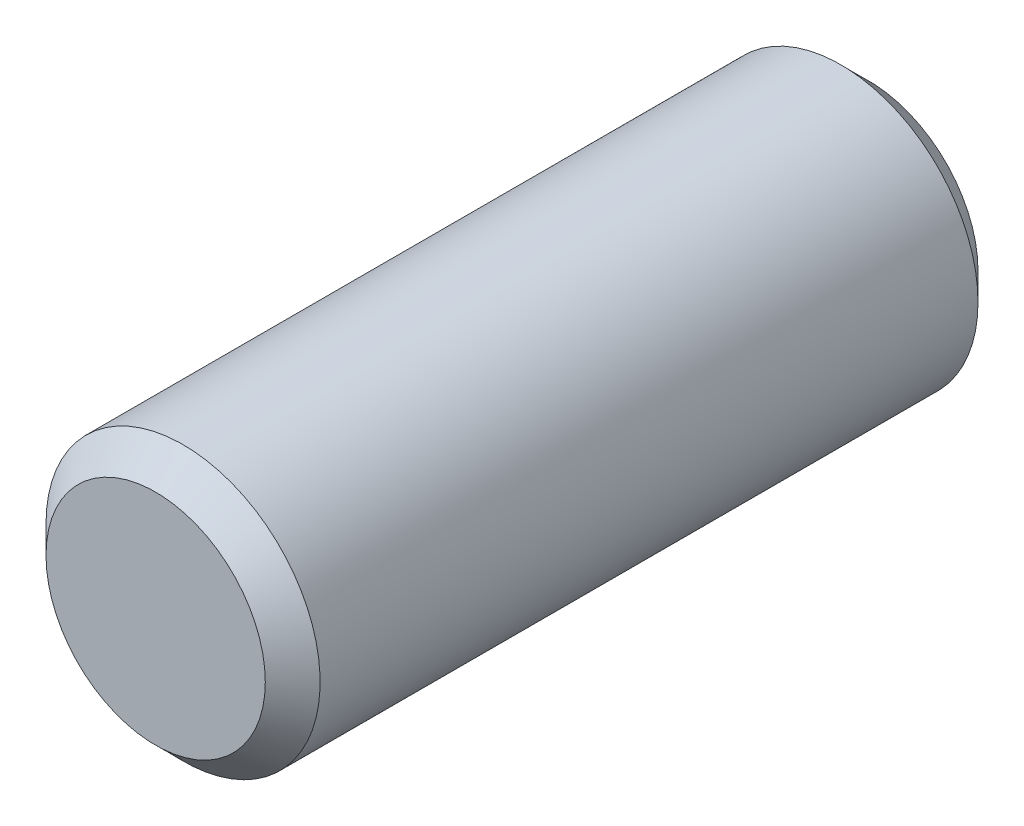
SolidWorks part; units mm, degrees
ref_plane "Front Plane" through (0, 0, 0) normal (0, 0, 1) x (1, 0, 0)
ref_plane "Top Plane" through (0, 0, 0) normal (0, 1, 0) x (1, 0, 0)
ref_plane "Right Plane" through (0, 0, 0) normal (1, 0, 0) x (0, 0, -1)
sketch "Sketch1" plane through (0, 0, 0) normal (0, 0, 1) x (1, 0, 0)
  circle A0 centre (0, 0) radius 10
  dimension "D1" = 20
extrude "Boss-Extrude1" add sketch "Sketch1" along normal mid plane 52
chamfer "Chamfer1" distance 2 angle 45 2 edges at (10, 0, -26) (10, 0, 26)
